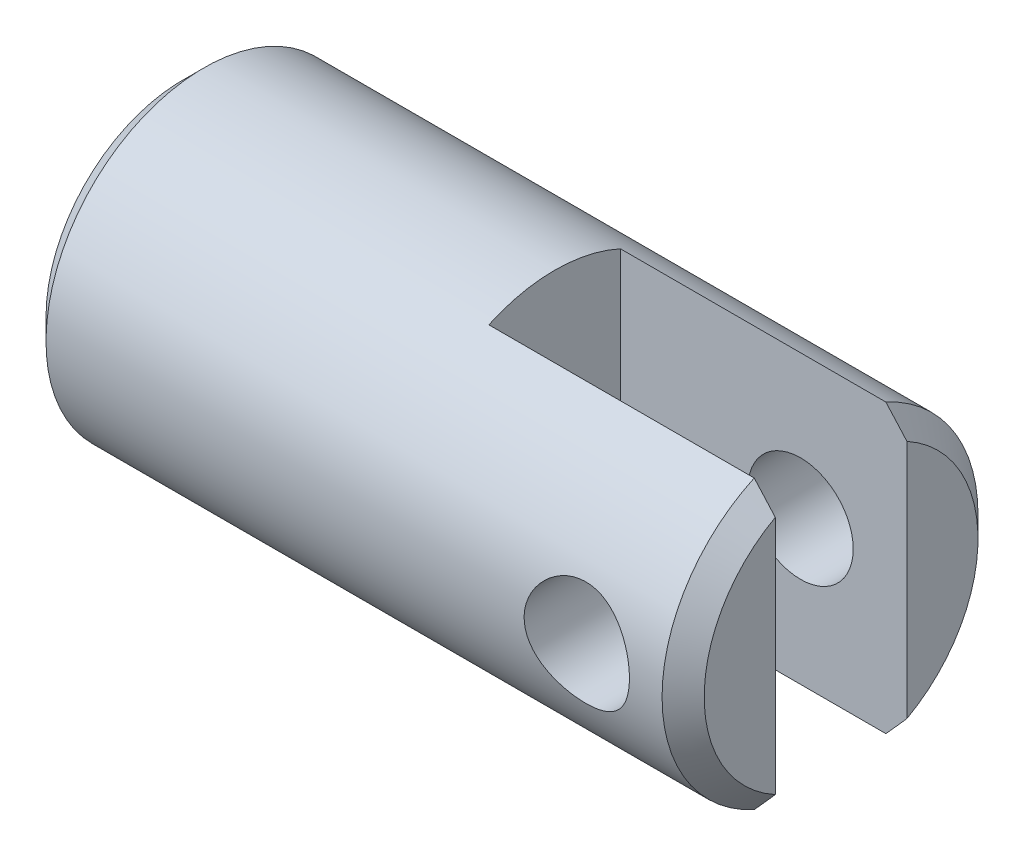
SolidWorks part; units mm, degrees
ref_plane "Front" through (0, 0, 0) normal (0, 0, 1) x (1, 0, 0)
ref_plane "Top" through (0, 0, 0) normal (0, 1, 0) x (1, 0, 0)
ref_plane "Right" through (0, 0, 0) normal (1, 0, 0) x (0, 0, -1)
sketch "Sketch1" plane through (0, 0, 0) normal (1, 0, 0) x (0, 0, -1)
  circle A0 centre (0, 0) radius 9.525
  dimension "D1" = 19.05
extrude "Base-Extrude" add sketch "Sketch1" along normal blind 39.6875
sketch "Sketch2" plane through (39.6875, 0, 0) normal (1, 0, 0) x (0, 0, -1)
  line L0 (0, 0) -> (0, 11.9045) construction
  line L1 (-3.9688, 8.6588) -> (-3.9688, -8.6588)
  line L3 (3.9688, -8.6588) -> (3.9688, 8.6588)
  arc A0 (3.9688, 8.6588) -> (-3.9688, 8.6588) centre (0, 0) ccw
  circle A1 centre (0, 0) radius 9.525
  arc A2 (-3.9688, -8.6588) -> (3.9688, -8.6588) centre (0, 0) ccw
  dimension "D2" = 7.9375
  dimension "D1" = 0
extrude "Cut-Extrude1" cut sketch "Sketch2" against normal blind 17.272
sketch "Sketch3" plane through (0, 0, 0) normal (0, 0, 1) x (1, 0, 0)
  line L0 (39.6875, 0) -> (22.4155, 0) construction
  line L1 (0, 0) -> (33.274, 0) construction
  circle A0 centre (33.274, 0) radius 3.175
  dimension "D1" = 6.35
  dimension "D2" = 33.274
extrude "Cut-Extrude2" cut sketch "Sketch3" against normal through all and the other way through all
chamfer "Chamfer1" distance 1.27 angle 45 3 edges at (0, 0, -9.525) (39.6875, 0, 9.525) (39.6875, 0, -9.525)
sketch "Sketch4" plane through (0, 0, 0) normal (-1, 0, 0) x (0, 0, 1)
  circle A0 centre (0, 0) radius 3.175
  dimension "D1" = 6.35
extrude "Cut-Extrude3" cut sketch "Sketch4" against normal blind 19.05
